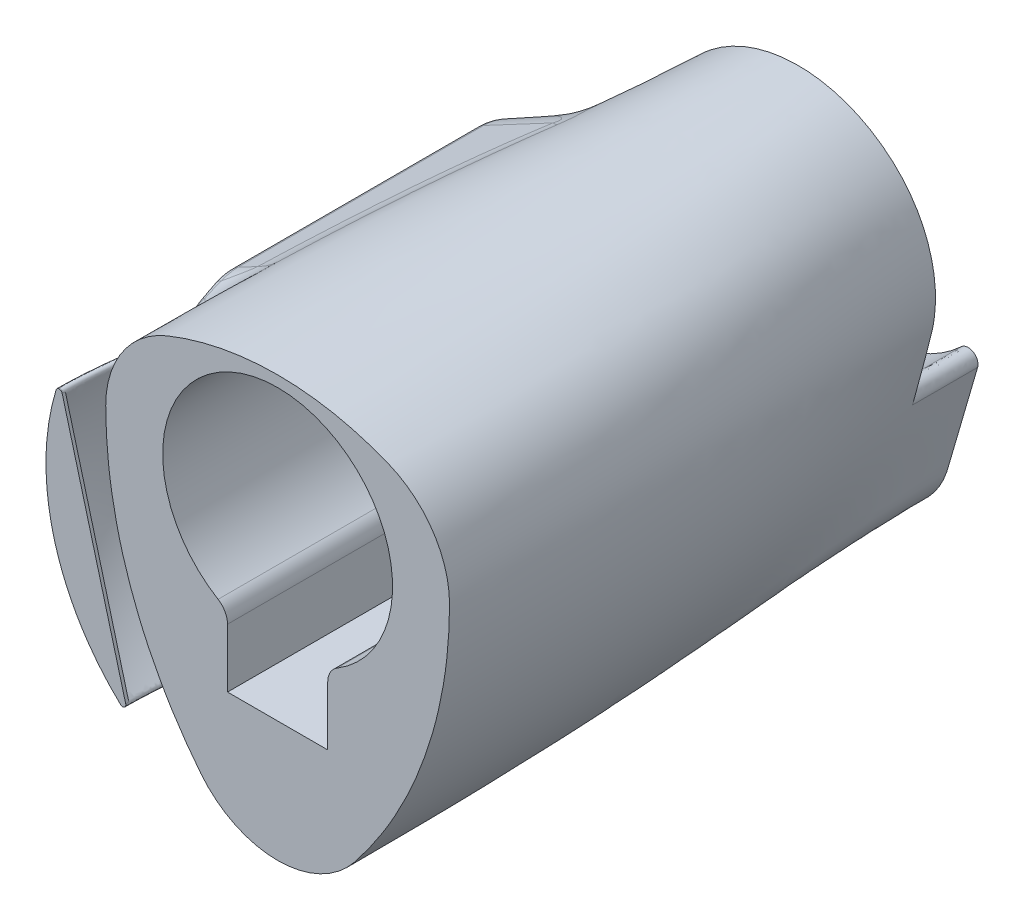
SolidWorks part; units mm, degrees
ref_plane "Front Plane" through (0, 0, 0) normal (0, 0, 1) x (1, 0, 0)
ref_plane "Top Plane" through (0, 0, 0) normal (0, 1, 0) x (1, 0, 0)
ref_plane "Right Plane" through (0, 0, 0) normal (1, 0, 0) x (0, 0, -1)
sketch "Sketch1" plane through (0, 0, 0) normal (0, 0, 1) x (1, 0, 0)
  line L1 (-16.6797, -4.8156) -> (-10.16, -27.3976)
  line L2 (16.6797, -4.8156) -> (10.16, -27.3976)
  line L3 (0, -35.0393) -> (0, 17.3609) construction
  circle A6 centre (0, 0) radius 14.605 construction
  arc A14 (-10.16, -27.3976) -> (10.16, -27.3976) centre (0, -24.4643) ccw
  arc A15 (-16.6797, -4.8156) -> (-12.7, 11.8368) centre (0, 0) cw
  arc A16 (16.6797, -4.8156) -> (12.7, 11.8368) centre (0, 0) ccw
  arc A17 (-12.7, 11.8368) -> (12.7, 11.8368) centre (0, 0) cw
  dimension "D1" = 17.3609
  dimension "D2" = 52.4002
  dimension "D7" = 29.21
  dimension "D5" = 25.4
  dimension "D4" = 20.32
ref_plane "End Plane" through (0, 0, 80.264) normal (0, 0, 1) x (1, 0, 0)
sketch "Sketch4" plane through (0, 0, 80.264) normal (0, 0, 1) x (1, 0, 0)
  line L0 (0, 16.1695) -> (0, -8.8103) construction
  line L1 (-22.225, 1.7278) -> (-22.225, 11.2362) construction
  arc A0 (-14.2875, 13.501) -> (14.2875, 13.501) centre (0, -21.8186) cw
  arc A1 (-14.2875, 13.501) -> (-22.225, 1.7278) centre (-9.525, 1.7278) ccw
  arc A2 (14.2875, 13.501) -> (22.225, 1.7278) centre (9.525, 1.7278) cw
  arc A3 (-22.225, 1.7278) -> (-9.9123, -33.3395) centre (33.8684, 1.7278) ccw
  arc A4 (22.225, 1.7278) -> (9.9123, -33.3395) centre (-33.8684, 1.7278) cw
  circle A6 centre (0, 0) radius 14.605 construction
  arc A7 (-9.9123, -33.3395) -> (9.9123, -33.3395) centre (0, -25.4) ccw
  point P12 (0, 16.2814)
  point P33 (0, 14.605)
  dimension "D1" = 12.7
  dimension "D3" = 38.1
  dimension "D2" = 1.6764
  dimension "D4" = 44.45
  dimension "D5" = 25.4
loft "Loft4" add profiles "Sketch1", "Sketch4"
ref_plane "Plane4" through (0, 0, 45.72) normal (0, 0, 1) x (1, 0, 0)
sketch "Sketch10" plane through (0, 0, 45.72) normal (0, 0, 1) x (1, 0, 0)
  line L0 (-19.0473, 2.6341) -> (-10.8298, -28.0341) construction
  line L1 (-17.5139, 3.0449) -> (-9.2964, -27.6232)
  line L2 (-20.5807, 2.2232) -> (-12.3632, -28.4449)
  line L3 (-15.5794, -4.1745) -> (-14.1073, -3.7801) construction
  line L5 (0, 0) -> (15.6651, 0) construction
  arc A0 (-17.5139, 3.0449) -> (-20.5807, 2.2232) centre (-19.0473, 2.6341) ccw
  arc A1 (-12.3632, -28.4449) -> (-9.2964, -27.6232) centre (-10.8298, -28.0341) ccw
  circle A2 centre (0, 0) radius 14.605 construction
  spline S0 degree 3 number of poles 138 (-13.9749, 13.1733) -> (-13.9749, 13.1733)
  spline S1 degree 3 number of poles 138 (-13.9749, 13.1733) -> (-13.9749, 13.1733) construction
  point P3 (-14.9385, -12.7)
  dimension "D1" = 31.75
  dimension "D2" = 3.175
  dimension "D3" = 1.524
  dimension "D4" = 75
  dimension "D5" = 12.7
ref_plane "Plane5" through (-14.9385, -12.7, 45.72) normal (0.2588, -0.9659, 0) x (-0.9659, -0.2588, 0)
sketch "Sketch11" plane through (-14.9385, -12.7, 45.72) normal (0.2588, -0.9659, 0) x (-0.9659, -0.2588, 0)
  line L0 (8.8523, 12.7) -> (8.8523, -12.7) construction
  arc A0 (0.901, 9.525) -> (0.901, -9.525) centre (50.8, 0) ccw
  arc A1 (0.901, 9.525) -> (8.8523, 12.7) centre (5.8909, 8.5725) cw
  arc A2 (0.901, -9.525) -> (8.8523, -12.7) centre (5.8909, -8.5725) ccw
  arc A3 (0.901, -9.525) -> (0.901, 9.525) centre (50.8, 0) ccw construction
  dimension "D1" = 101.6
  dimension "D2" = 19.05
  dimension "D3" = 5.08
  dimension "D4" = 25.4
ref_plane "Plane6" through (-18.6462, -4.9962, 0) normal (-0.9659, -0.2588, 0) x (0.2588, -0.9659, 0)
ref_plane "Plane7" through (-22.3264, -5.9823, 0) normal (-0.9659, -0.2588, 0) x (0.2588, -0.9659, 0)
sketch "Sketch13" plane through (-22.3264, -5.9823, 0) normal (-0.9659, -0.2588, 0) x (0.2588, -0.9659, 0)
  line L1 (-6.2041, 67.945) -> (23.0059, 67.945)
  line L2 (-12.5541, 61.595) -> (-12.5541, 29.845)
  line L3 (-6.2041, 23.495) -> (23.0059, 23.495)
  line L4 (29.3559, 61.595) -> (29.3559, 29.845)
  line L6 (-7.4741, 45.72) -> (24.2759, 45.72) construction
  arc A0 (-6.2041, 23.495) -> (-12.5541, 29.845) centre (-6.2041, 29.845) cw
  arc A1 (23.0059, 23.495) -> (29.3559, 29.845) centre (23.0059, 29.845) ccw
  arc A2 (23.0059, 67.945) -> (29.3559, 61.595) centre (23.0059, 61.595) cw
  arc A3 (-6.2041, 67.945) -> (-12.5541, 61.595) centre (-6.2041, 61.595) ccw
  point P4 (-12.5541, 45.72)
  point P13 (-12.5541, 23.495)
  point P20 (-12.5541, 67.945)
  dimension "D4" = 6.35
  dimension "D1" = 5.08
  dimension "D2" = 5.08
  dimension "D3" = 44.45
  dimension "D5" = 0
extrude "Boss-Extrude3" add sketch "Sketch13" against normal up to body draft 13 separate body
sweep "Cut-Sweep3" cut profiles "Sketch10" path "Sketch11"
fillet "Fillet17" radius 12.7 6 edges at (-10.935, -31.8754, 67.016) (-20.1306, 8.3718, 64.5857) (-18.2721, 10.0274, 50.6314) (-14.8381, 11.2222, 26.6794) (-7.5609, -33.1908, 26.1164) (-7.9311, -34.1006, 40.4549)
fillet "Fillet21" radius 2.54 12 edges at (-14.8376, -33.9311, 27.5708) (-25.3684, 5.3705, 26.7582) (-25.5757, 6.144, 45.72) (-25.5264, 5.96, 63.1386) (-14.7487, -34.2626, 62.5871) (-14.7285, -34.338, 45.72) (-20.1521, -14.097, 67.945) (-20.1521, -14.097, 23.495) (-15.7032, -30.7005, 24.0446) (-15.4058, -31.8106, 66.7315) (-24.7769, 3.1631, 67.0419) (-24.3828, 1.6923, 23.7384)
fillet "Fillet20" radius 1.27 8 edges at (-16.4451, -27.9318, 59.6834) (-20.1521, -14.097, 57.75) (-24.6713, 2.7689, 59.4222) (-16.4486, -27.9186, 32.3546) (-20.1521, -14.097, 30.4983) (-24.6712, 2.7686, 32.1709) (-20.1521, -14.097, 60.9417) (-20.1521, -14.097, 33.69)
sketch "Sketch16" plane through (0, 0, 0) normal (0, 0, -1) x (-1, 0, 0)
  line L0 (-6.477, -14.8802) -> (-6.477, -22.479)
  line L1 (-6.477, -22.479) -> (6.477, -22.479)
  line L2 (6.477, -22.479) -> (6.477, -14.8802)
  line L3 (0, -22.479) -> (0, 0) construction
  arc A0 (7.7006, -12.7079) -> (-7.7006, -12.7079) centre (0, 0) ccw
  arc A1 (6.477, -14.8802) -> (7.7006, -12.7079) centre (9.017, -14.8802) cw
  arc A2 (-6.477, -14.8802) -> (-7.7006, -12.7079) centre (-9.017, -14.8802) ccw
  dimension "D1" = 2.54
  dimension "D2" = 14.859
  dimension "D3" = 12.954
  dimension "D4" = 37.084
extrude "Cut-Extrude3" cut sketch "Sketch16" against normal through all
sketch "Sketch17" plane through (0, 0, 0) normal (0, 0, -1) x (-1, 0, 0)
  circle A0 centre (0, 0) radius 17.526
  dimension "D1" = 35.052
extrude "Cut-Extrude4" cut sketch "Sketch17" against normal blind 12.954
sketch "Sketch18" plane through (0, 0, 0) normal (0, 0, -1) x (-1, 0, 0)
  line L0 (-17.024, -4.1646) -> (-11.1026, -28.37)
  line L1 (11.1026, -28.37) -> (17.024, -4.1646)
  arc A0 (-17.024, -4.1646) -> (17.024, -4.1646) centre (0, 0) cw
  arc A1 (-11.1026, -28.37) -> (11.1026, -28.37) centre (0, -25.654) ccw
  arc A2 (6.477, -16.2852) -> (11.796, 12.9621) centre (0, 0) ccw construction
  point P7 (0, 17.526)
  point P12 (0, -37.084)
  dimension "D1" = 54.61
  dimension "D2" = 11.43
extrude "Cut-Extrude5" cut sketch "Sketch18" against normal blind 3.81
sketch "Sketch19" plane through (-22.3264, -5.9823, 0) normal (-0.9659, -0.2588, 0) x (-0.0002, 0.0007, 1)
  text T0 "HOFF  TACT  MIL  SPEC  GEN 2" font "Arial Rounded MT Bold" height 3.5
extrude "Cut-Extrude6" cut sketch "Sketch19" against normal blind 0.508
ref_plane "Plane8" through (0, 0, 56.9153) normal (0, 0, 1) x (1, 0, 0)
ref_plane "Plane9" through (0, 0, 57.1693) normal (0, 0, 1) x (1, 0, 0)
sketch "Sketch20" plane through (0, 0, 56.9153) normal (0, 0, 1) x (1, 0, 0)
  line L0 (-23.0341, 1.5658) -> (-14.8166, -29.1023) construction
  line L1 (-22.6416, 1.671) -> (-14.4241, -28.9972)
  line L2 (-23.4267, 1.4606) -> (-15.2092, -29.2075)
  arc A0 (-22.6416, 1.671) -> (-23.4267, 1.4606) centre (-23.0341, 1.5658) ccw
  arc A1 (-15.2092, -29.2075) -> (-14.4241, -28.9972) centre (-14.8166, -29.1023) ccw
  point P2 (-18.9254, -13.7683)
  dimension "D1" = 0.8128
sketch "Sketch22" plane through (0, 0, 57.1693) normal (0, 0, 1) x (1, 0, 0)
  line L2 (-14.4241, -28.9972) -> (-22.6416, 1.671)
  line L3 (-23.4267, 1.4606) -> (-15.2092, -29.2075)
  line L4 (-14.4241, -28.9972) -> (-22.6416, 1.671)
  line L5 (-23.4267, 1.4606) -> (-15.2092, -29.2075)
  arc A2 (-15.2092, -29.2075) -> (-14.4241, -28.9972) centre (-14.8166, -29.1023) ccw
  arc A3 (-22.6416, 1.671) -> (-23.4267, 1.4606) centre (-23.0341, 1.5658) ccw
  arc A4 (-15.2092, -29.2075) -> (-14.4241, -28.9972) centre (-14.8166, -29.1023) ccw
  arc A5 (-22.6416, 1.671) -> (-23.4267, 1.4606) centre (-23.0341, 1.5658) ccw
  dimension "D1" = 0
sketch "Sketch21" plane through (0, 0, 80.264) normal (0, 0, 1) x (1, 0, 0)
  line L0 (-18.9254, -13.7683) -> (-28.1258, -16.2335) construction
  line L1 (-23.0341, 1.5658) -> (-14.8166, -29.1023) construction
  arc A0 (-20.3105, -30.7965) -> (-28.6391, 0.286) centre (0.5305, -8.5551) cw
  arc A1 (-19.7548, -30.2034) -> (-27.8612, 0.0503) centre (0.5305, -8.5551) cw
  arc A2 (-20.3105, -30.7965) -> (-19.7548, -30.2034) centre (-20.0327, -30.5) ccw
  arc A3 (-28.6391, 0.286) -> (-27.8612, 0.0503) centre (-28.2502, 0.1682) cw
  dimension "D1" = 0.8128
  dimension "D3" = 30.48
  dimension "D2" = 31.75
  dimension "D4" = 9.525
loft "Loft6" add profiles "Sketch21", "Sketch22"
sketch "Sketch23" plane through (0, 0, 80.264) normal (0, 0, 1) x (1, 0, 0)
  line L0 (-27.8576, 0.2733) -> (-19.6401, -30.3948)
  arc A4 (-20.3105, -30.7965) -> (-19.7548, -30.2034) centre (-20.0327, -30.5) ccw
  arc A5 (-27.8612, 0.0503) -> (-19.7548, -30.2034) centre (0.5305, -8.5551) ccw
  arc A6 (-27.8612, 0.0503) -> (-28.6391, 0.286) centre (-28.2502, 0.1682) ccw
  arc A7 (-28.6391, 0.286) -> (-20.3105, -30.7965) centre (0.5305, -8.5551) ccw
  arc A8 (-20.3105, -30.7965) -> (-19.6401, -30.3948) centre (-20.0327, -30.5) ccw
  arc A10 (-27.8576, 0.2733) -> (-28.6391, 0.286) centre (-28.2502, 0.1682) ccw
  arc A11 (-28.6391, 0.286) -> (-20.3105, -30.7965) centre (0.5305, -8.5551) ccw
  dimension "D1" = 0
extrude "Boss-Extrude4" add sketch "Sketch23" against normal blind 0.4064
fillet "Fillet22" radius 1.27 2 edges at (17.3938, -2.1483, 8.9996) (-17.106, -3.8139, 9.1714)
